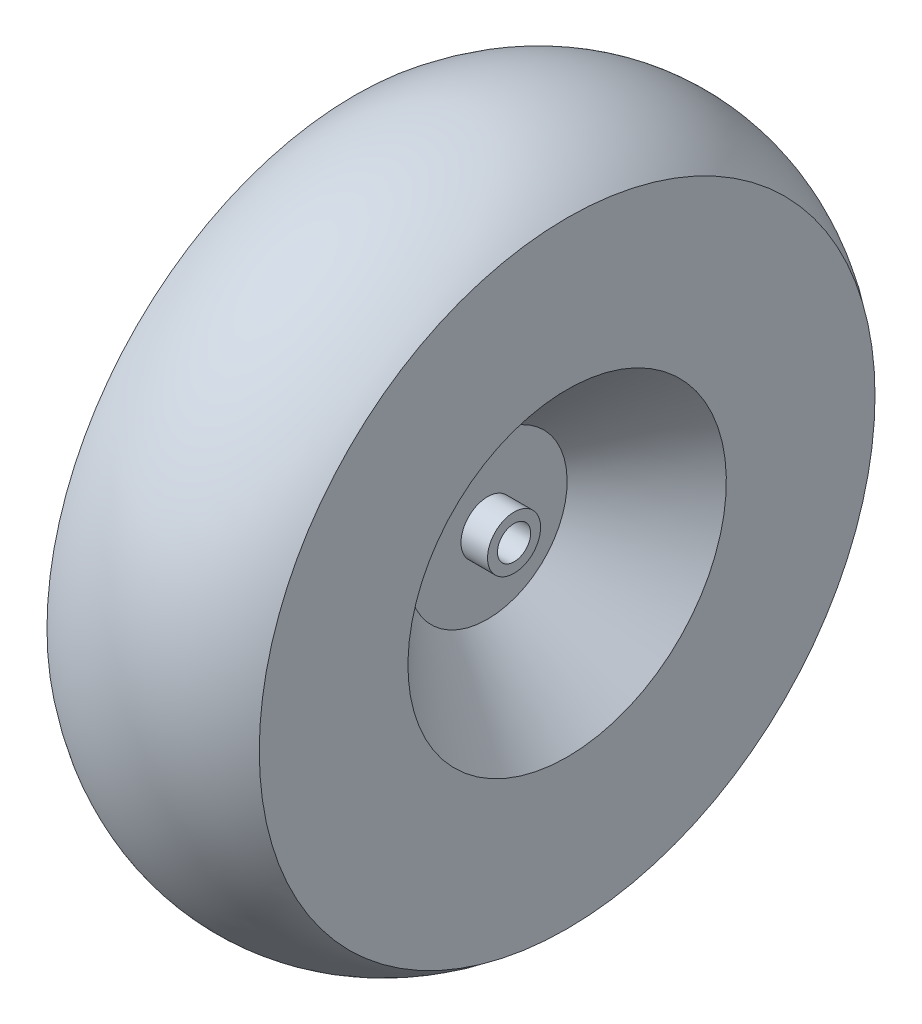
SolidWorks part; units mm, degrees
ref_plane "Front Plane" through (0, 0, 0) normal (0, 0, 1) x (1, 0, 0)
ref_plane "Top Plane" through (0, 0, 0) normal (0, 1, 0) x (1, 0, 0)
ref_plane "Right Plane" through (0, 0, 0) normal (1, 0, 0) x (0, 0, -1)
sketch "Sketch7" plane through (0, 0, 0) normal (0, 0, 1) x (1, 0, 0)
  line L4 (25.4, 7.9375) -> (25.4, 12.7)
  line L6 (12.7, 12.7) -> (25.4, 12.7)
  line L8 (12.7, 12.7) -> (12.7, 38.1)
  line L11 (-25.4, 0) -> (25.4, 0) construction
  line L12 (12.7, 38.1) -> (50.8, 76.2)
  line L13 (50.8, 76.2) -> (50.8, 147.3587)
  line L16 (25.4, 7.9375) -> (-25.4, 7.9375)
  line L44 (-12.7, 12.7) -> (12.7, 12.7) construction
  line L49 (-50.8, 147.3587) -> (50.8, 147.3587) construction
  line L53 (-50.8, 76.2) -> (-50.8, 147.3587)
  line L54 (-12.7, 38.1) -> (-50.8, 76.2)
  line L55 (-12.7, 12.7) -> (-12.7, 38.1)
  line L56 (-12.7, 12.7) -> (-25.4, 12.7)
  line L57 (-25.4, 7.9375) -> (-25.4, 12.7)
  ellipse E1 centre (0, 79.5701) end of major axis (0, -5.9598) minor radius 83.3088 (50.8, 147.3587) -> (-50.8, 147.3587) ccw
  point P5 (0, 0)
  point P6 (0, 12.7)
  point P8 (0, 147.3587)
  point P59 (50.8, 147.3587)
  dimension "D1" = 50.8
  dimension "D2" = 7.9375
  dimension "D3" = 101.6
  dimension "D4" = 76.2
  dimension "D5" = 165.1
  dimension "D6" = 45
  dimension "D8" = 25.4
  dimension "D9" = 12.7
revolve "Revolve6" add sketch "Sketch7" angle 360 about L11
